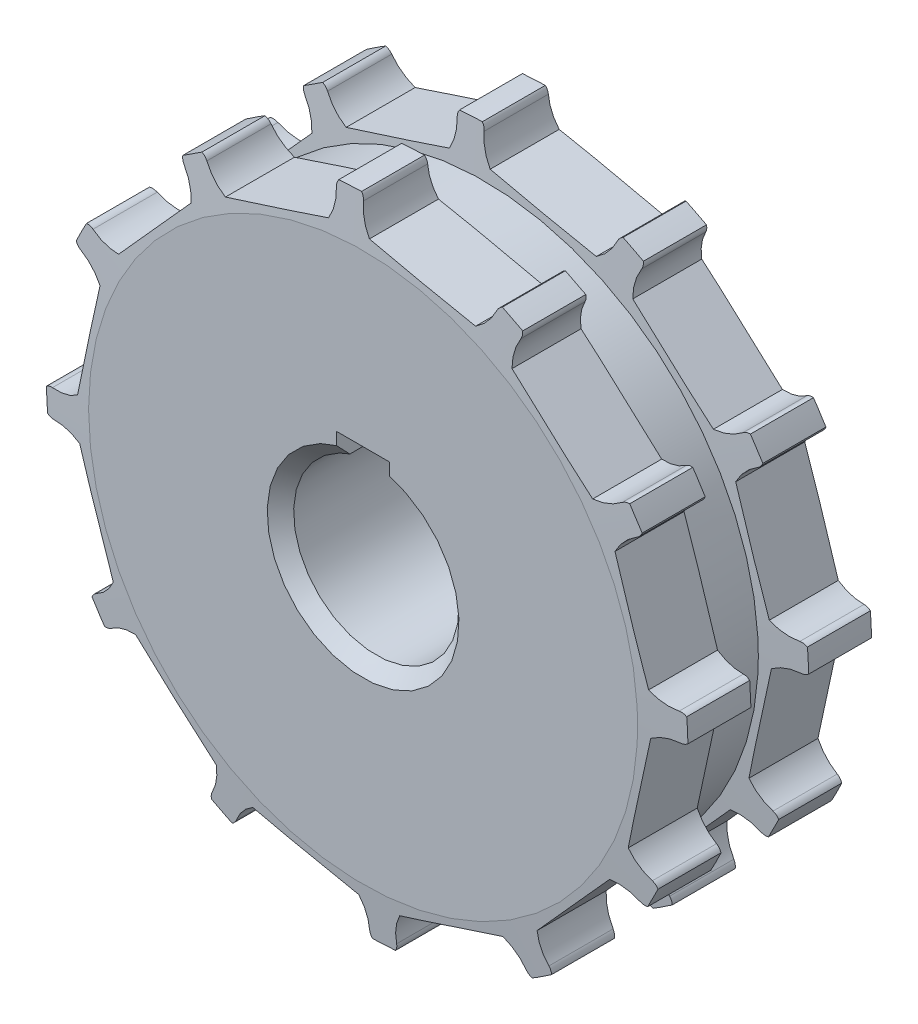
SolidWorks part; units mm, degrees
ref_plane "Alzado" through (0, 0, 0) normal (0, 0, 1) x (1, 0, 0)
ref_plane "Planta" through (0, 0, 0) normal (0, 1, 0) x (1, 0, 0)
ref_plane "Vista lateral" through (0, 0, 0) normal (1, 0, 0) x (0, 0, -1)
sketch "Croquis1" plane through (0, 0, 0) normal (0, 0, 1) x (1, 0, 0)
  circle A0 centre (0, 0) radius 48.5
  circle A1 centre (0, 0) radius 12.5
  circle A2 centre (0, 0) radius 49.747 construction
  dimension "D1" = 97
  dimension "D2" = 25
  dimension "D3" = 99.4941
extrude "Extruir1" add sketch "Croquis1" along normal mid plane 29
sketch "Croquis2" plane through (0, 0, 0) normal (0, 0, 1) x (1, 0, 0)
  circle A0 centre (0, 0) radius 48.5 construction
  circle A1 centre (0, 0) radius 48.5
  circle A2 centre (0, 0) radius 41.5
  dimension "D1" = 83
extrude "Cortar-Extruir1" cut sketch "Croquis2" against normal mid plane 7.5
chamfer "Chaflán1" distance 2 angle 45 2 edges at (12.5, 0, -14.5) (12.5, 0, 14.5)
chamfer "Chaflán2" distance 7 angle 5 2 edges at (48.5, 0, 3.75) (48.5, 0, -14.5)
chamfer "Chaflán3" distance 7 angle 5 2 edges at (48.5, 0, -3.75) (48.5, 0, 14.5)
sketch "Croquis3" plane through (0, 0, 0) normal (0, 0, 1) x (1, 0, 0)
  line L0 (0, 0) -> (0, 88.3104) construction
  line L1 (0, 0) -> (44.0434, 76.2854) construction
  line L2 (0, 0) -> (78.7121, 45.4445) construction
  line L3 (0, 0) -> (90.5637, 0) construction
  line L4 (0, 0) -> (83.115, -47.9865) construction
  line L5 (0, 0) -> (45.6157, -79.0087) construction
  line L6 (0, 0) -> (0, -99.1226) construction
  line L7 (0, 0) -> (-45.8799, -79.4662) construction
  line L8 (0, 0) -> (-89.0977, -51.4406) construction
  line L9 (0, 0) -> (-97.3156, 0) construction
  line L10 (0, 0) -> (-78.8299, 45.5125) construction
  line L11 (0, 0) -> (-46.6283, 80.7626) construction
  dimension "D1" = 30
  dimension "D2" = 30
  dimension "D3" = 30
  dimension "D4" = 30
  dimension "D5" = 30
  dimension "D6" = 30
  dimension "D7" = 30
  dimension "D8" = 30
  dimension "D9" = 30
  dimension "D10" = 30
  dimension "D11" = 30
  dimension "D12" = 30
sketch "Croquis5" plane through (0, 0, 0) normal (0, 0, 1) x (1, 0, 0)
  line L0 (0, 0) -> (13.3726, 63.0849) construction
  line L2 (1.1472, 43.0614) -> (-12.4888, 42.3468) construction
  line L4 (-4.5471, 50.8836) -> (-1.1708, 48.7765)
  line L8 (11.2542, 43.2088) -> (10.6982, 43.5298) construction
  line L9 (10.2354, 43.5377) -> (4.8868, 43.2574) construction
  line L10 (0.8011, 43.3221) -> (16.8446, 39.9212)
  line L11 (20.8599, 44.1065) -> (24.8008, 44.6625)
  line L12 (24.8008, 44.6625) -> (32.5939, 81.4261)
  line L13 (0, 0) -> (0, 31.4472) construction
  line L14 (3.246, 87.6472) -> (32.5939, 81.4261)
  line L15 (14.6739, -3.1106) -> (28.0466, 59.9744) construction
  line L17 (-4.5471, 50.8836) -> (3.246, 87.6472)
  circle A0 centre (0, 0) radius 43.3295 construction
  circle A1 centre (0, 0) radius 48.5 construction
  arc A2 (1.9134, 47.5619) -> (3.5786, 43.3849) centre (8.9038, 47.9282) ccw construction
  arc A3 (10.0575, 47.4457) -> (20.4397, 43.9826) centre (0, 0) ccw construction
  arc A4 (-0.4652, 47.475) -> (0.8011, 43.3221) centre (6.5335, 47.3396) ccw
  arc A6 (16.8446, 39.9212) -> (19.687, 43.2031) centre (13.2353, 45.9189) ccw
  arc A11 (-1.1708, 48.7765) -> (-0.4652, 47.475) centre (-1.9649, 47.504) cw
  arc A12 (20.8599, 44.1065) -> (19.687, 43.2031) centre (21.0695, 42.6212) ccw
  arc A13 (1.9134, 47.5619) -> (3.7443, 43.1975) centre (8.9038, 47.9282) ccw construction
  dimension "D3" = 6.2881
  dimension "D6" = 20
  dimension "D7" = 15
  dimension "D5" = 1.5
  dimension "D11" = 10.3
  dimension "D12" = 20
  dimension "D2" = 7
  dimension "D9" = 3.8
  dimension "D10" = 16.4
  dimension "D4" = 8.2
  dimension "D8" = 15
  dimension "D18" = 5.9535
  dimension "D16" = 20.6
  dimension "D19" = 86.659
  dimension "D13" = 22.5202
  dimension "D14" = 4.9269
  dimension "D15" = 6.2881
  dimension "D17" = 3.8
extrude "Cortar-Extruir2" cut sketch "Croquis5" against normal through all and the other way through all
pattern_circular "MatrizC1" count 12 over 360 about axis through (0, 0, 0) along (0, 0, 1) of "Cortar-Extruir2"
sketch "Croquis6" plane through (0, 0, 14.5) normal (0, 0, 1) x (1, 0, 0)
  line L1 (-4, 0) -> (4, 0)
  line L2 (-4, 0) -> (-4, 15.8)
  line L3 (-4, 15.8) -> (4, 15.8)
  line L4 (4, 0) -> (4, 15.8)
  dimension "D1" = 8
  dimension "D3" = 15.8
extrude "Cortar-Extruir3" [suppressed] cut sketch "Croquis6" against normal through all
sketch "Croquis7" plane through (0, 0, 14.5) normal (0, 0, 1) x (1, 0, 0)
  line L1 (-12.5, 12.5) -> (12.5, 12.5)
  line L2 (-12.5, 12.5) -> (-12.5, -12.5)
  line L3 (-12.5, -12.5) -> (12.5, -12.5)
  line L4 (12.5, 12.5) -> (12.5, -12.5)
  dimension "D1" = 25
  dimension "D2" = 25
  dimension "D3" = 12.5
  dimension "D4" = 12.5
extrude "Cortar-Extruir4" [suppressed] cut sketch "Croquis7" against normal blind 30
sketch "Croquis8" plane through (0, 0, 0) normal (0, 0, 1) x (1, 0, 0)
  circle A0 centre (0, 0) radius 49.075 construction
  dimension "D1" = 98.15
sketch "Croquis9" plane through (0, 0, 0) normal (0, 0, 1) x (1, 0, 0)
  line L0 (-4, 15.8) -> (4, 15.8)
  line L1 (0, -12.5) -> (0, 15.8) construction
  line L2 (-4, 15.8) -> (-4, 9.0664)
  line L3 (-4, 9.0664) -> (4, 9.0664)
  line L4 (4, 9.0664) -> (4, 15.8)
  point P7 (0, 15.8)
  dimension "D1" = 28.3
  dimension "D2" = 8
extrude "Cortar-Extruir5" cut sketch "Croquis9" against normal through all both and the other way through all
